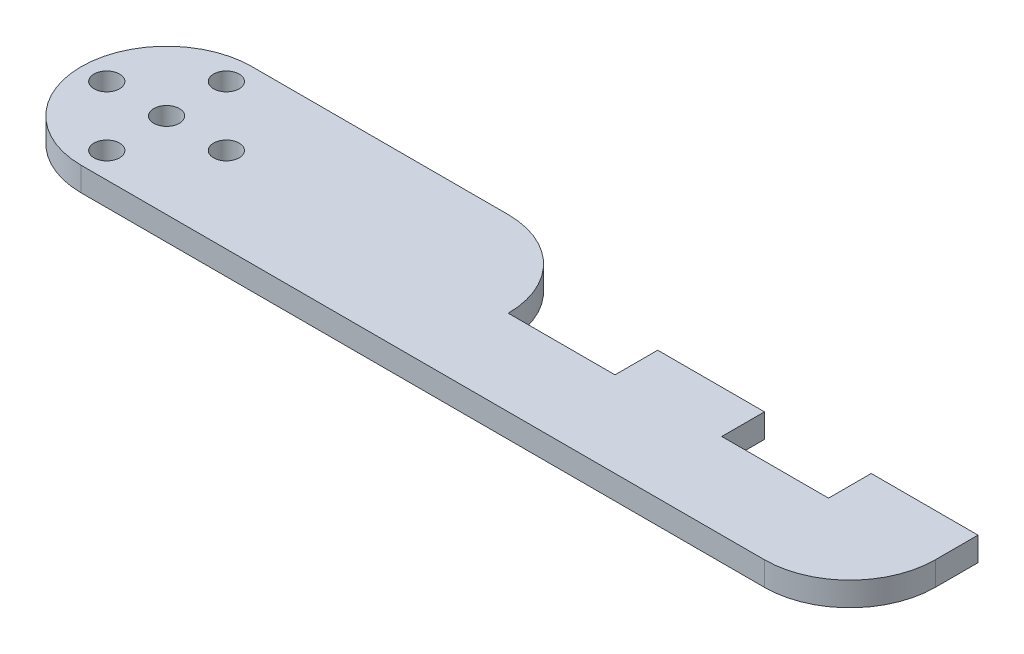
SolidWorks part; units mm, degrees
ref_plane "Front Plane" through (0, 0, 0) normal (0, 0, 1) x (1, 0, 0)
ref_plane "Top Plane" through (0, 0, 0) normal (0, 1, 0) x (1, 0, 0)
ref_plane "Right Plane" through (0, 0, 0) normal (1, 0, 0) x (0, 0, -1)
sketch "Sketch1" plane through (0, 0, 0) normal (0, 1, 0) x (1, 0, 0)
  line L1 (0, 0) -> (100, 0)
  line L2 (0, 0) -> (0, 20)
  line L6 (50, 10) -> (50, 20)
  line L7 (50, 20) -> (0, 20)
  line L9 (62.5, 10) -> (62.5, 20) construction
  line L10 (62.5, 20) -> (75, 20) construction
  line L11 (75, 20) -> (75, 15) construction
  line L12 (75, 15) -> (62.5, 15) construction
  line L13 (62.5, 15) -> (62.5, 10) construction
  line L14 (62.5, 10) -> (75, 10) construction
  line L15 (75, 10) -> (75, 15) construction
  line L16 (75, 15) -> (75, 10) construction
  line L18 (87.5, 10) -> (87.5, 15) construction
  line L19 (87.5, 15) -> (100, 15) construction
  line L20 (100, 15) -> (100, 10) construction
  line L21 (50, 10) -> (62.5, 10)
  line L22 (62.5, 10) -> (62.5, 15)
  line L23 (62.5, 15) -> (75, 15)
  line L24 (75, 15) -> (75, 10)
  line L25 (75, 10) -> (87.5, 10)
  line L26 (87.5, 10) -> (87.5, 15)
  line L27 (87.5, 15) -> (100, 15)
  line L28 (100, 15) -> (100, 0)
  point P17 (50.2018, 10)
extrude "Boss-Extrude1" add sketch "Sketch1" along normal blind 2.8
fillet "Fillet1" radius 10 2 edges at (0, 1.4, -20) (0, 1.4, 0)
sketch "Sketch2" plane through (0, 2.8, 0) normal (0, 1, 0) x (1, 0, 0)
  line L0 (10, 10) -> (10, 17) construction
  line L1 (10, 10) -> (10, 3) construction
  line L2 (10, 10) -> (17, 10) construction
  line L3 (10, 10) -> (3, 10) construction
  circle A0 centre (10, 10) radius 1.5
  circle A1 centre (3, 10) radius 1.5
  circle A2 centre (10, 3) radius 1.5
  circle A3 centre (17, 10) radius 1.5
  circle A4 centre (10, 17) radius 1.5
extrude "Cut-Extrude1" cut sketch "Sketch2" against normal blind 2.8
fillet "Fillet2" radius 10 1 edges at (50, 1.4, -20)
fillet "Fillet4" radius 10 1 edges at (100, 1.4, 0)
